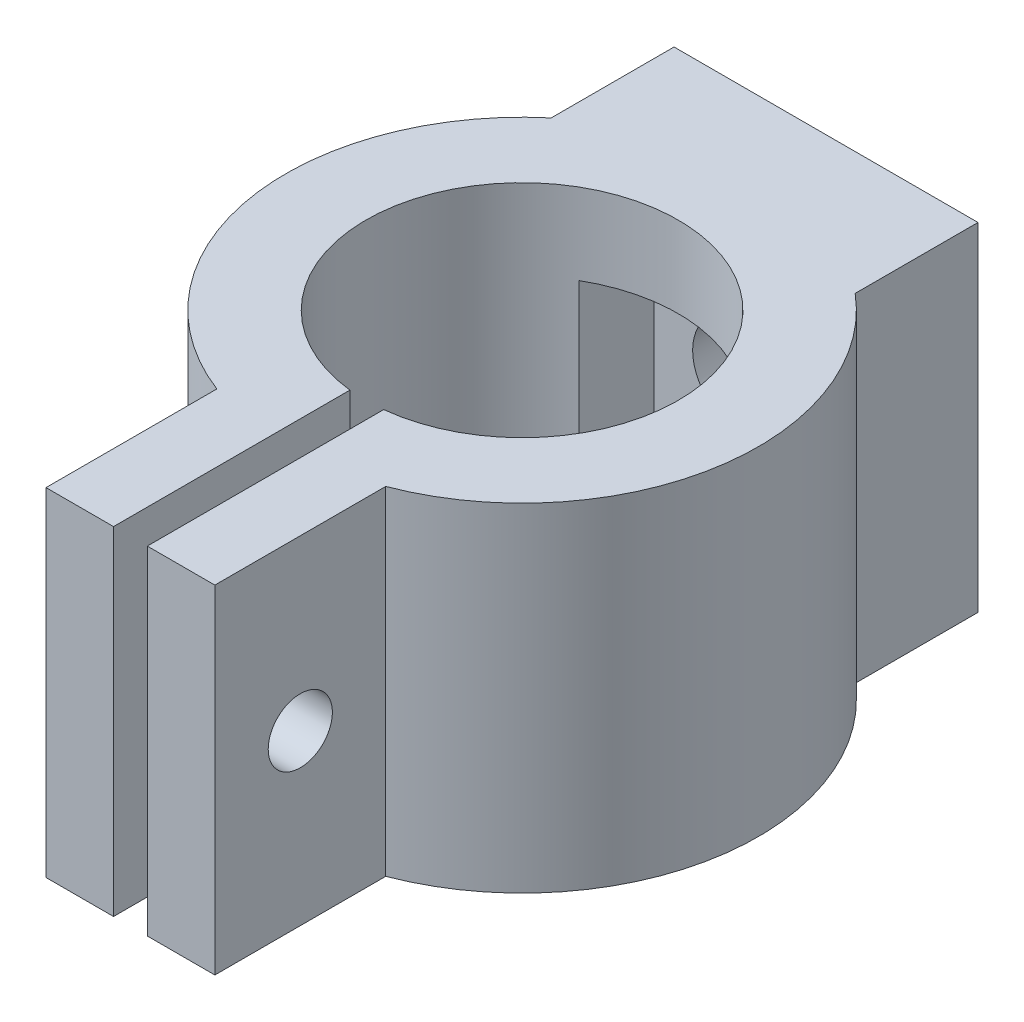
SolidWorks part; units mm, degrees
ref_plane "Front Plane" through (0, 0, 0) normal (0, 0, 1) x (1, 0, 0)
ref_plane "Top Plane" through (0, 0, 0) normal (0, 1, 0) x (1, 0, 0)
ref_plane "Right Plane" through (0, 0, 0) normal (1, 0, 0) x (0, 0, -1)
sketch "Sketch1" plane through (0, 0, 0) normal (0, 1, 0) x (1, 0, 0)
  line L0 (-4.5, 0) -> (4.5, 0)
  line L1 (4.5, 0) -> (4.5, -3.6381)
  line L2 (-4.5, 0) -> (-4.5, -3.6381)
  line L3 (0, -13.6993) -> (0, 3.8872) construction
  line L4 (0.5, -13.5979) -> (0.5, -20.5979)
  line L5 (2.5, -15.5383) -> (2.5, -20.5979)
  line L6 (2.5, -13.5979) -> (2.5, -20.5979) construction
  line L7 (2.5, -20.5979) -> (0.5, -20.5979)
  line L8 (-0.5, -13.5979) -> (-0.5, -20.5979)
  line L9 (-2.5, -20.5979) -> (-0.5, -20.5979)
  line L10 (-2.5, -15.5383) -> (-2.5, -20.5979)
  arc A0 (-4.5, -3.6381) -> (-2.5, -15.5383) centre (0, -9) ccw
  arc A2 (0.5, -13.5979) -> (-0.5, -13.5979) centre (0, -9) ccw
  arc A3 (2.5, -15.5383) -> (4.5, -3.6381) centre (0, -9) ccw
  dimension "D1" = 14
  dimension "D5" = 2
  dimension "D4" = 9.25
  dimension "D2" = 9
  dimension "D3" = 9
  dimension "D6" = 0.5
  dimension "D7" = 7
extrude "Boss-Extrude1" add sketch "Sketch1" along normal blind 10 contours A2 L8 L9 L10 A0 L2 L0 L1 A3 L5 L7 L4
sketch "Sketch2" plane through (0, 0, 0) normal (0, 0, -1) x (-1, 0, 0)
  line L0 (-2.394, 5) -> (2.7936, 5) construction
  line L1 (4.5, 10) -> (-4.5, 10) construction
  line L2 (4.5, 0) -> (-4.5, 0) construction
  circle A0 centre (0, 5) radius 1.45
  dimension "D1" = 2.9
extrude "Cut-Extrude1" cut sketch "Sketch2" against normal blind 5
sketch "Sketch3" plane through (-2.5, 0, 0) normal (-1, 0, 0) x (0, 0, 1)
  line L0 (15.3148, 5) -> (18.4274, 5) construction
  line L1 (15.5383, 10) -> (20.5979, 10) construction
  line L2 (15.5383, 0) -> (20.5979, 0) construction
  line L3 (18.0681, 4.448) -> (18.0681, 0.7886) construction
  line L4 (15.5383, 10) -> (15.5383, 0) construction
  line L5 (20.5979, 10) -> (20.5979, 0) construction
  circle A0 centre (18.0681, 5) radius 0.95
  dimension "D1" = 1.9
extrude "Cut-Extrude2" cut sketch "Sketch3" against normal blind 5 contours A0
ref_plane "Plane1" through (0, 0, 5) normal (0, 0, -1) x (-1, 0, 0)
sketch "Sketch4" plane through (0, 0, 5) normal (0, 0, -1) x (-1, 0, 0)
  line L1 (-2.6, 7.6) -> (2.6, 7.6)
  line L2 (-2.6, 7.6) -> (-2.6, 2.4)
  line L3 (-2.6, 2.4) -> (2.6, 2.4)
  line L4 (2.6, 7.6) -> (2.6, 2.4)
  line L5 (-2.6, 7.6) -> (2.6, 2.4) construction
  line L6 (-2.6, 2.4) -> (2.6, 7.6) construction
  point P0 (0, 5)
  dimension "D1" = 5.2
extrude "Cut-Extrude3" cut sketch "Sketch4" along normal blind 2.5
